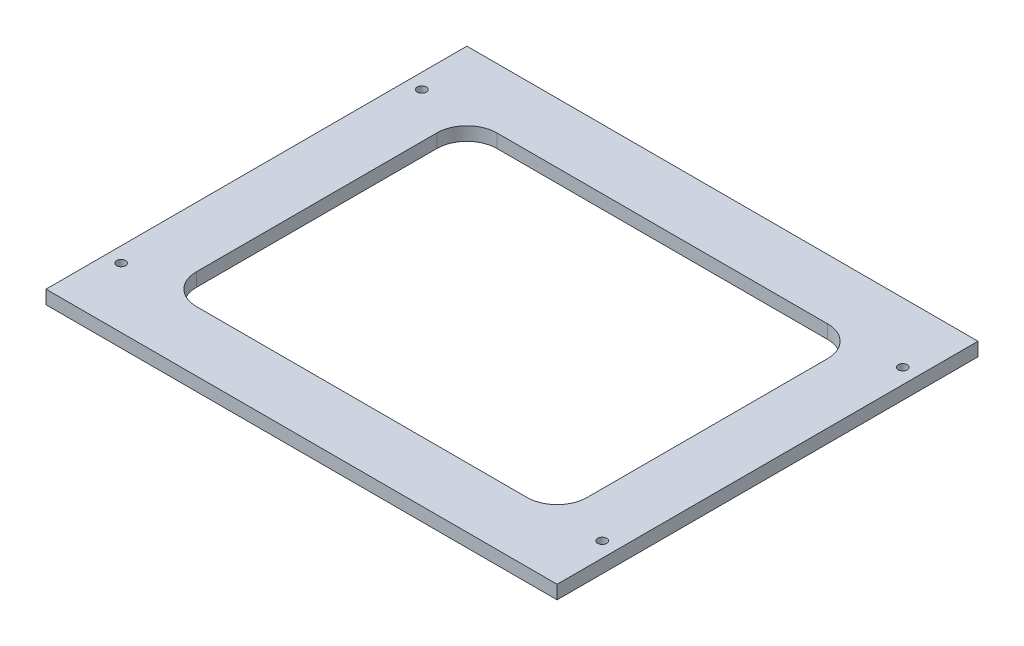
SolidWorks part; units mm, degrees
ref_plane "Front Plane" through (0, 0, 0) normal (0, 0, 1) x (1, 0, 0)
ref_plane "Top Plane" through (0, 0, 0) normal (0, 1, 0) x (1, 0, 0)
ref_plane "Right Plane" through (0, 0, 0) normal (1, 0, 0) x (0, 0, -1)
ref_plane "Plane1" through (0, 4.5, 0) normal (0, 1, 0) x (1, 0, 0)
sketch "Sketch1" plane through (0, 4.5, 0) normal (0, 1, 0) x (1, 0, 0)
  line L0 (38.6364, -68.0528) -> (38.6364, 71.9472)
  line L1 (38.6364, 71.9472) -> (-131.3636, 71.9472)
  line L2 (-131.3636, 71.9472) -> (-131.3636, -68.0528)
  line L3 (-131.3636, -68.0528) -> (38.6364, -68.0528)
  line L4 (8.6364, -48.0528) -> (-101.3636, -48.0528)
  line L5 (-111.3636, -38.0528) -> (-111.3636, 41.9472)
  line L6 (-101.3636, 51.9472) -> (8.6364, 51.9472)
  line L7 (18.6364, 41.9472) -> (18.6364, -38.0528)
  arc A0 (-101.3636, -48.0528) -> (-111.3636, -38.0528) centre (-101.3636, -38.0528) cw
  arc A1 (-111.3636, 41.9472) -> (-101.3636, 51.9472) centre (-101.3636, 41.9472) cw
  arc A2 (8.6364, 51.9472) -> (18.6364, 41.9472) centre (8.6364, 41.9472) cw
  arc A3 (18.6364, -38.0528) -> (8.6364, -48.0528) centre (8.6364, -38.0528) cw
extrude "Boss-Extrude1" add sketch "Sketch1" against normal blind 4.5
sketch "Sketch2" plane through (0, 4.5, 0) normal (0, 1, 0) x (1, 0, 0)
  line L0 (38.6364, 71.9472) -> (-131.3636, 71.9472) construction
  line L1 (-131.3636, 71.9472) -> (-131.3636, -68.0528) construction
  line L2 (-131.3636, -68.0528) -> (38.6364, -68.0528) construction
  line L3 (38.6364, -68.0528) -> (38.6364, 71.9472) construction
  circle A0 centre (-126.3636, 51.9472) radius 1.5
  circle A1 centre (33.6364, 51.9472) radius 1.5
  circle A2 centre (33.6364, -48.0528) radius 1.5
  circle A3 centre (-126.3636, -48.0528) radius 1.5
  dimension "D1" = 3
  dimension "D2" = 20
  dimension "D3" = 5
  dimension "D4" = 20
  dimension "D5" = 5
extrude "Cut-Extrude1" cut sketch "Sketch2" against normal up to next
